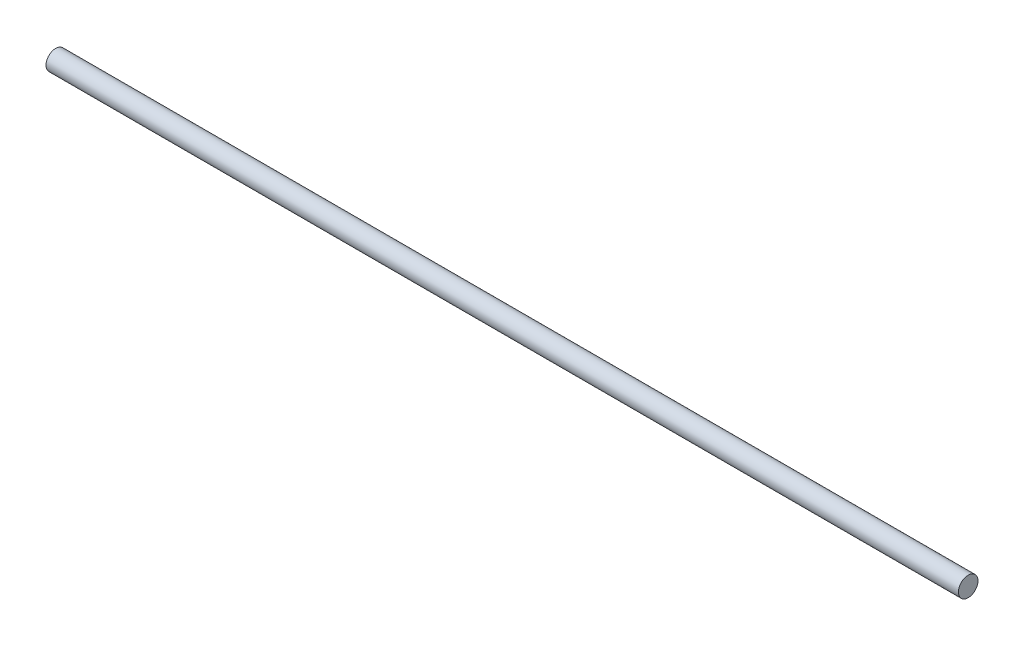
SolidWorks part; units mm, degrees
ref_plane "Front Plane" through (0, 0, 0) normal (0, 0, 1) x (1, 0, 0)
ref_plane "Top Plane" through (0, 0, 0) normal (0, 1, 0) x (1, 0, 0)
ref_plane "Right Plane" through (0, 0, 0) normal (1, 0, 0) x (0, 0, -1)
sketch "Sketch1" plane through (0, 0, 0) normal (1, 0, 0) x (0, 0, -1)
  circle A0 centre (0, 0) radius 3
  dimension "D1" = 6
extrude "Boss-Extrude1" add sketch "Sketch1" along normal blind 280
